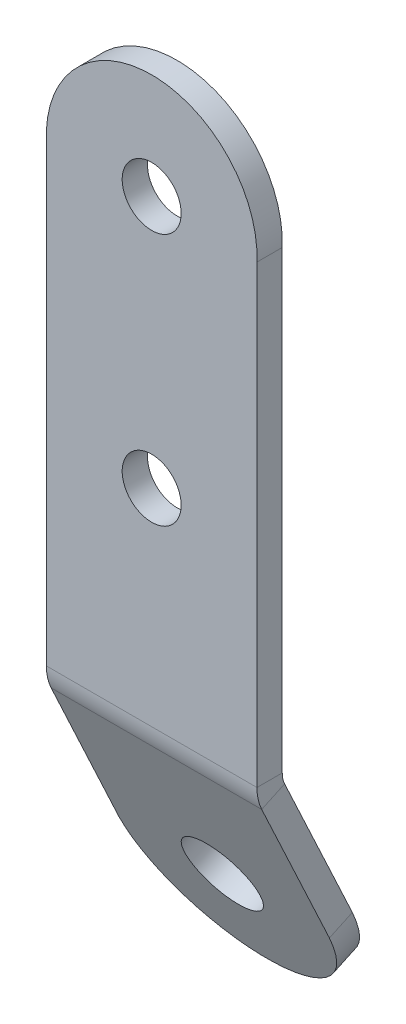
SolidWorks part; units mm, degrees
ref_plane "Plan1" through (0, 0, 0) normal (0, 0, 1) x (1, 0, 0)
ref_plane "Plan2" through (0, 0, 0) normal (0, 1, 0) x (1, 0, 0)
ref_plane "Plan3" through (0, 0, 0) normal (1, 0, 0) x (0, 0, -1)
sketch "Esquisse1" plane through (0, 0, 0) normal (0, 0, 1) x (1, 0, 0)
  line L0 (15, 75) -> (15, 0)
  line L1 (-10, 76) -> (-10, 0)
  circle A0 centre (2.5, 75.5) radius 3.5
  arc A1 (15, 75) -> (-10, 76) centre (2.5, 75.5) ccw
  arc A2 (-10, 0) -> (15, 0) centre (2.5, 0.5) ccw
  circle A3 centre (2.5, 45.5) radius 3.5
  circle A4 centre (2.5, 0.5) radius 4.5
  dimension "D4" = 9
  dimension "D5" = 25
  dimension "D2" = 45
  dimension "D3" = 7
  dimension "D1" = 30
extrude "Base-Extrusion" add sketch "Esquisse1" along normal blind 3
sheet metal parameters "Tôlerie 1" parameters "D1"=3, "Epaisseur"=3
flatten bends "Dépliage 1" parameters "D1"=0
sketch "Esquisse-Angle1" plane through (0, 0, 3) normal (0, 0, 1) x (1, 0, 0)
process bends "Pliage 1" parameters "D1"=3
sketch "Esquisse-Plate1" plane through (0, 0, 3) normal (0, 0, 1) x (1, 0, 0)
  line L2 (-10, 76) -> (-10, 0) construction
  line L6 (15, 75) -> (15, 0) construction
  line L7 (-10, 20) -> (15, 20) construction
  point P0 (2.5, 25)
  dimension "D2" = 20
bend "Pli défini à plat2" bend radius 3 bend angle 25 parameters "D5"=1
